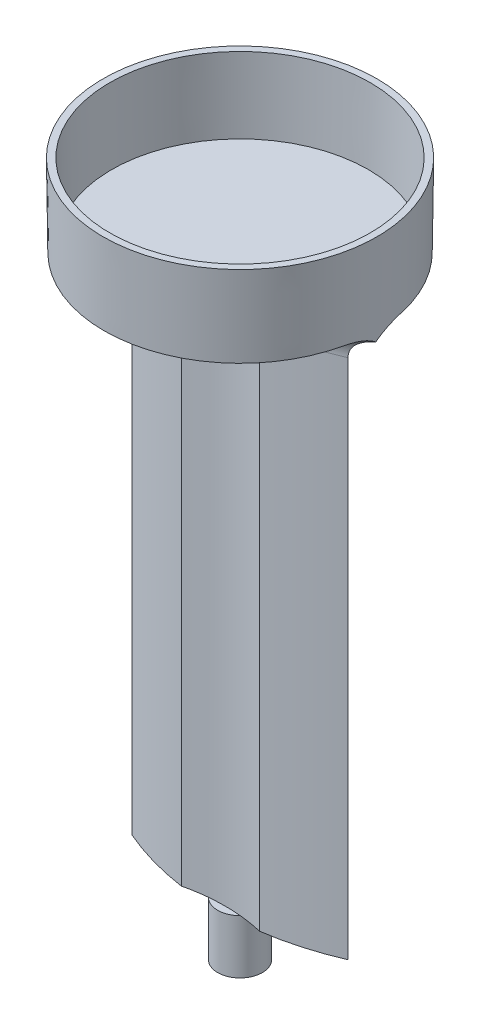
SolidWorks part; units mm, degrees
ref_plane "Спереди" through (0, 0, 0) normal (0, 0, 1) x (1, 0, 0)
ref_plane "Сверху" through (0, 0, 0) normal (0, 1, 0) x (1, 0, 0)
ref_plane "Справа" through (0, 0, 0) normal (1, 0, 0) x (0, 0, -1)
sketch "Эскиз2" plane through (0, 0, 0) normal (0, 0, 1) x (1, 0, 0)
  line L5 (0, 0) -> (0, 50) construction
  line L9 (-34.49, 0) -> (0, 0)
  line L24 (0, 0) -> (0, -2)
  line L26 (-36.5, -2) -> (0, -2)
  line L53 (-34.97, 20) -> (-34.49, 0)
  line L55 (-36.77, 20) -> (-36.5, -2)
  line L56 (-34.97, 20) -> (-36.77, 20)
revolve "Повернуть1" add sketch "Эскиз2" angle 360 about L5
sketch "Эскиз3" plane through (0, -2, 0) normal (0, -1, 0) x (1, 0, 0)
  arc A1 (-29, 0) -> (29, 0) centre (0, 67) ccw
  arc A2 (-29, 0) -> (29, 0) centre (0, -67) cw
extrude "Бобышка-Вытянуть1" add sketch "Эскиз3" along normal blind 150
sketch "Эскиз5" plane through (0, -152, 0) normal (0, -1, 0) x (1, 0, 0)
  line L0 (-29, 0) -> (29, 0) construction
  line L1 (-10.5, -5.2478) -> (-11.0122, -16.092)
  line L2 (-11.0122, -16.092) -> (10.5, -16.7557)
  line L3 (10.5, -16.7557) -> (10.5, -5.2478)
  line L4 (-11.0122, 16.092) -> (10.5, 16.7557)
  line L5 (10.5, 16.7557) -> (10.5, 5.2478)
  line L6 (-10.5, 5.2478) -> (-11.0122, 16.092)
  arc A0 (-29, 0) -> (29, 0) centre (0, 67) ccw construction
  arc A1 (-10.5, -5.2478) -> (10.5, -5.2478) centre (0, -49.0476) cw
  arc A2 (-10.5, 5.2478) -> (10.5, 5.2478) centre (0, 49.0476) ccw
extrude "Вырез-Вытянуть2" cut sketch "Эскиз5" against normal blind 150
fillet "Скругление2" radius 10 6 edges at (-19.9235, -2, 3.2357) (19.9235, -2, 3.2357) (0, -2, 4.0068) (-19.9235, -2, -3.2357) (19.9235, -2, -3.2357) (0, -2, -4.0068)
sketch "Эскиз6" plane through (0, -152, 0) normal (0, -1, 0) x (1, 0, 0)
  circle A0 centre (0, 0) radius 6
extrude "Бобышка-Вытянуть2" add sketch "Эскиз6" along normal blind 14.5
